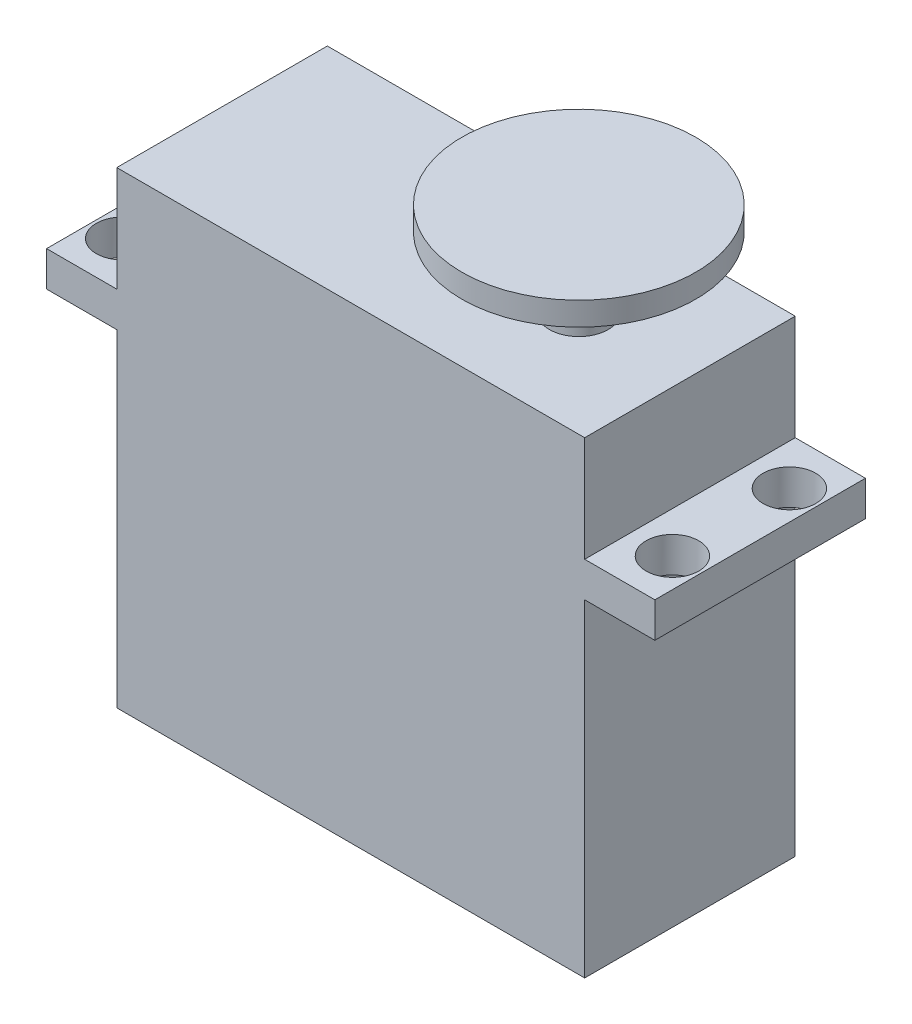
SolidWorks part; units mm, degrees
ref_plane "Front Plane" through (0, 0, 0) normal (0, 0, 1) x (1, 0, 0)
ref_plane "Top Plane" through (0, 0, 0) normal (0, 1, 0) x (1, 0, 0)
ref_plane "Right Plane" through (0, 0, 0) normal (1, 0, 0) x (0, 0, -1)
sketch "Sketch1" plane through (0, 0, 0) normal (0, 1, 0) x (1, 0, 0)
  line L1 (0, 0) -> (40, 0)
  line L2 (0, 0) -> (0, 18)
  line L3 (0, 18) -> (40, 18)
  line L4 (40, 0) -> (40, 18)
  dimension "D1" = 40
  dimension "D2" = 18
extrude "Boss-Extrude1" add sketch "Sketch1" along normal blind 40
ref_plane "Plane1" through (0, 28, 0) normal (0, -1, 0) x (-1, 0, 0)
sketch "Sketch2" plane through (0, 28, 0) normal (0, -1, 0) x (-1, 0, 0)
  line L1 (-40, 0) -> (-46, 0)
  line L2 (-40, 0) -> (-40, 18)
  line L3 (-40, 18) -> (-46, 18)
  line L4 (-46, 0) -> (-46, 18)
  line L5 (0, 18) -> (6, 18)
  line L6 (0, 18) -> (0, 0)
  line L7 (0, 0) -> (6, 0)
  line L8 (0, 0) -> (0, 18)
  line L9 (-40, 0) -> (0, 0)
  line L10 (-40, 18) -> (-40, 0)
  line L11 (0, 18) -> (-40, 18)
  line L12 (0, 0) -> (0, 18)
  line L13 (-40, 0) -> (0, 0)
  line L14 (-40, 18) -> (-40, 0)
  line L15 (0, 18) -> (-40, 18)
  line L16 (6, 18) -> (6, 0)
  point P4 (0, -0.3926)
  dimension "D2" = 6
  dimension "D3" = 6
  dimension "D1" = 0
extrude "Boss-Extrude2" add sketch "Sketch2" against normal blind 3 contours L16 L5 L6 L7 | L4 L1 L2 L3
sketch "Sketch3" plane through (0, 40, 0) normal (0, 1, 0) x (1, 0, 0)
  line L0 (30.5, 18) -> (30.5, 0) construction
  line L1 (40, 18) -> (0, 18) construction
  line L2 (0, 0) -> (40, 0) construction
  line L3 (40, 0) -> (40, 18) construction
  circle A0 centre (30.5, 9) radius 2.5
  point P8 (33.6767, 9)
  dimension "D1" = 9.5
extrude "Boss-Extrude3" add sketch "Sketch3" along normal blind 6
sketch "Sketch4" plane through (0, 46, 0) normal (0, 1, 0) x (1, 0, 0)
  circle A0 centre (30.5, 9) radius 10
extrude "Boss-Extrude4" add sketch "Sketch4" along normal blind 2
sketch "Sketch5" plane through (0, 31, 0) normal (0, 1, 0) x (1, 0, 0)
  line L0 (0, 0) -> (-6, 0) construction
  line L4 (0, 18) -> (0, 0) construction
  line L5 (-3.5, 14) -> (-3.5, 4) construction
  circle A0 centre (-3.5, 14) radius 2.25
  circle A1 centre (-3.5, 4) radius 2.25
  dimension "D1" = 10
  dimension "D4" = 4.5
  dimension "D5" = 4.5
  dimension "D2" = 4
  dimension "D3" = 3.5
ref_plane "Plane2" through (20, 0, 0) normal (-1, 0, 0) x (0, 0, 1)
extrude "Cut-Extrude1" cut sketch "Sketch5" against normal up to next
mirror "Mirror1" about plane through (20, 0, 0) normal (-1, 0, 0) of "Cut-Extrude1"
